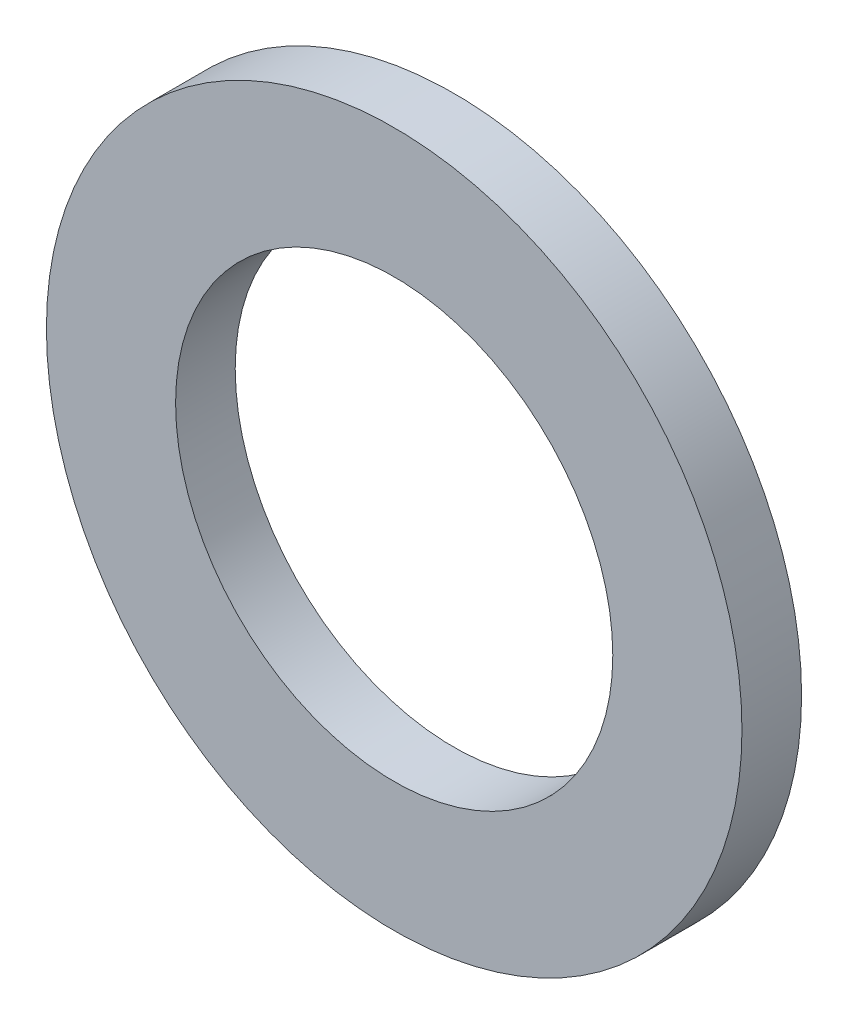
SolidWorks part; units mm, degrees
ref_plane "Plan de face" through (0, 0, 0) normal (0, 0, 1) x (1, 0, 0)
ref_plane "Plan de dessus" through (0, 0, 0) normal (0, 1, 0) x (1, 0, 0)
ref_plane "Plan de droite" through (0, 0, 0) normal (1, 0, 0) x (0, 0, -1)
sketch "Esquisse1" plane through (0, 0, 0) normal (0, 0, 1) x (1, 0, 0)
  circle A0 centre (0, 0) radius 11
  circle A1 centre (0, 0) radius 17.5
  dimension "D1" = 22
  dimension "D2" = 35
extrude "Extrusion1" add sketch "Esquisse1" along normal blind 3
